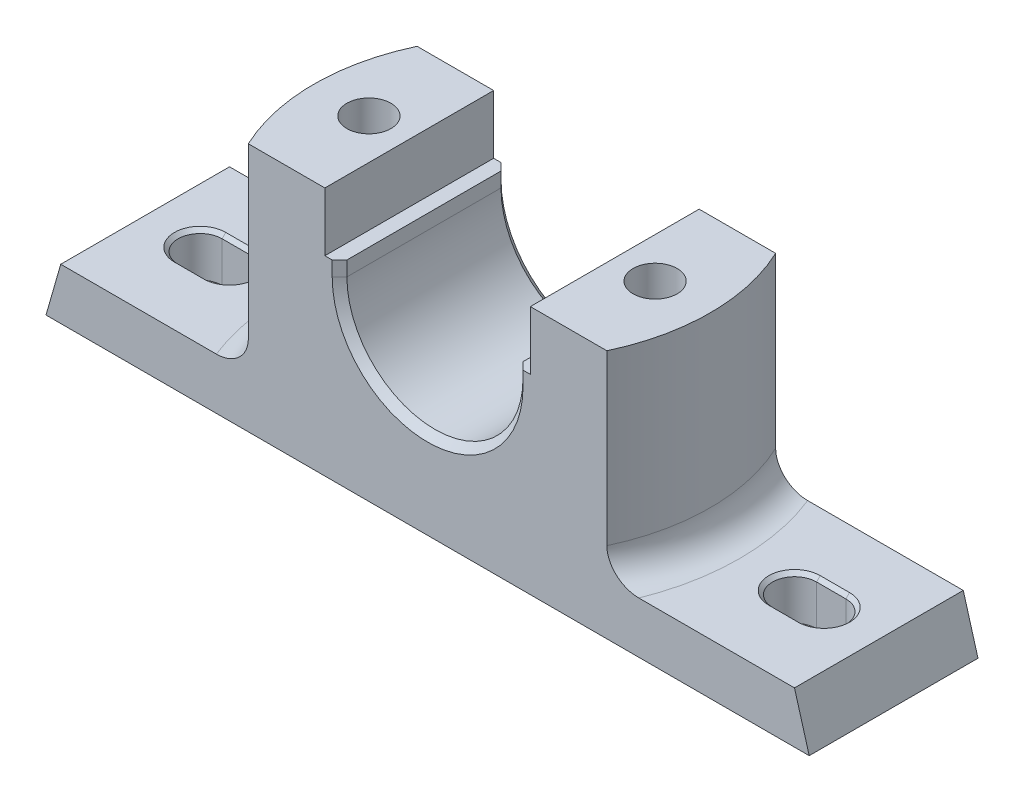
SolidWorks part; units mm, degrees
ref_plane "Front Plane" through (0, 0, 0) normal (0, 0, 1) x (1, 0, 0)
ref_plane "Top Plane" through (0, 0, 0) normal (0, 1, 0) x (1, 0, 0)
ref_plane "Right Plane" through (0, 0, 0) normal (1, 0, 0) x (0, 0, -1)
sketch "Sketch1" plane through (0, 0, 0) normal (0, 0, 1) x (1, 0, 0)
  line L0 (0, 0) -> (0, 97.2809) construction
  line L1 (-104, 0) -> (104, 0)
  line L2 (-104, 0) -> (-99.9856, 14)
  line L3 (104, 0) -> (99.9856, 14)
  line L4 (-99.9856, 14) -> (-54, 14)
  line L5 (99.9856, 14) -> (54, 14)
  line L6 (-54, 14) -> (-54, 68)
  line L7 (54, 14) -> (54, 68)
  line L8 (-54, 68) -> (-28, 68)
  line L9 (54, 68) -> (28, 68)
  line L10 (-28, 68) -> (-28, 52)
  line L11 (28, 68) -> (28, 52)
  line L12 (-28, 52) -> (-24, 52)
  line L13 (28, 52) -> (24, 52)
  line L14 (-24, 52) -> (-24, 48)
  line L15 (24, 52) -> (24, 48)
  arc A1 (-24, 48) -> (24, 48) centre (0, 48) ccw
  dimension "D5" = 48
  dimension "D9" = 4
  dimension "D1" = 208
  dimension "D2" = 68
  dimension "D3" = 14
  dimension "D4" = 106
  dimension "D6" = 56
  dimension "D7" = 54
  dimension "D8" = 16
extrude "Boss-Extrude1" add sketch "Sketch1" along normal mid plane 46
sketch "Sketch2" plane through (0, 68, 0) normal (0, 1, 0) x (1, 0, 0)
  line L0 (-48.8569, 23) -> (48.8569, 23)
  line L1 (48.8569, -23) -> (-48.8569, -23)
  line L3 (-28, -23) -> (-54, -23) construction
  line L8 (-54, -23) -> (-54, 23) construction
  line L9 (-28, 23) -> (-54, 23) construction
  line L10 (54, -23) -> (54, 23) construction
  line L12 (-48.8569, 23) -> (48.8569, -23) construction
  line L13 (48.8569, 23) -> (-48.8569, -23) construction
  arc A0 (-48.8569, 23) -> (-48.8569, -23) centre (0, 0) ccw
  arc A1 (48.8569, 23) -> (48.8569, -23) centre (0, 0) cw
  dimension "D1" = 54
extrude "Cut-Extrude1" cut sketch "Sketch2" against normal up to surface (54 mm away) flip side to cut
sketch "Sketch4" plane through (0, 0, 0) normal (0, -1, 0) x (1, 0, 0)
  line L0 (-104, 0) -> (104, 0) construction
  line L1 (-97.5, 17.5) -> (97.5, 17.5)
  line L2 (-97.5, 17.5) -> (-97.5, -17.5)
  line L3 (-97.5, -17.5) -> (97.5, -17.5)
  line L4 (97.5, 17.5) -> (97.5, -17.5)
  line L5 (-104, 23) -> (-104, -23) construction
  line L6 (104, 23) -> (104, -23) construction
  line L7 (0, 23) -> (0, -23) construction
  line L8 (-104, 23) -> (104, 23) construction
  line L9 (-104, -23) -> (104, -23) construction
  dimension "D1" = 195
  dimension "D2" = 35
extrude "Cut-Extrude2" cut sketch "Sketch4" against normal blind 2
sketch "Sketch5" plane through (0, 2, 0) normal (0, -1, 0) x (1, 0, 0)
  line L0 (-39, 0) -> (39, 0) construction
  line L1 (-53, -14) -> (-25, -14)
  line L2 (-53, -14) -> (-53, 14)
  line L3 (-53, 14) -> (-25, 14)
  line L4 (-25, -14) -> (-25, 14)
  line L5 (-53, -14) -> (-25, 14) construction
  line L6 (-53, 14) -> (-25, -14) construction
  line L7 (25, -14) -> (53, -14)
  line L8 (25, -14) -> (25, 14)
  line L9 (25, 14) -> (53, 14)
  line L10 (53, -14) -> (53, 14)
  line L11 (25, -14) -> (53, 14) construction
  line L12 (25, 14) -> (53, -14) construction
  point P0 (-39, 0)
  point P5 (39, 0)
  point P12 (0, 0)
  dimension "D1" = 28
  dimension "D2" = 78
extrude "Cut-Extrude3" cut sketch "Sketch5" against normal blind 10
other "Hole1"
sketch "Sketch6" plane through (0, 68, 0) normal (0, 1, 0) x (1, 0, 0)
  line L0 (-39, 0) -> (0, 0) construction
  circle A0 centre (-39, 0) radius 6
  dimension "D1" = 12
  dimension "D2" = 39
other "Hole2"
sketch "Sketch7" plane through (0, 68, 0) normal (0, 1, 0) x (1, 0, 0)
  line L0 (0, 0) -> (39, 0) construction
  circle A0 centre (39, 0) radius 6
  circle A1 centre (-39, 0) radius 6 construction
  dimension "D1" = 12
  dimension "D2" = 78
sketch "Sketch8" plane through (0, 14, 0) normal (0, 1, 0) x (1, 0, 0)
  line L0 (77, 0) -> (85, 0) construction
  line L1 (77, 6) -> (85, 6)
  line L2 (77, -6) -> (85, -6)
  line L3 (-85, 0) -> (-77, 0) construction
  line L4 (-85, 6) -> (-77, 6)
  line L5 (-85, -6) -> (-77, -6)
  line L6 (-77, 0) -> (77, 0) construction
  arc A0 (77, 6) -> (77, -6) centre (77, 0) ccw
  arc A1 (85, -6) -> (85, 6) centre (85, 0) ccw
  arc A2 (-85, 6) -> (-85, -6) centre (-85, 0) ccw
  arc A3 (-77, -6) -> (-77, 6) centre (-77, 0) ccw
  point P2 (81, 0)
  point P9 (-81, 0)
  point P17 (0, 0)
  dimension "D5" = 154
  dimension "D1" = 12
  dimension "D2" = 8
  dimension "D3" = 12
  dimension "D4" = 8
extrude "Cut-Extrude4" cut sketch "Sketch8" against normal through all
fillet "Fillet1" radius 8 2 edges at (-54, 14, 0) (54, 14, 0)
chamfer "Chamfer1" distance 1 angle 45 8 edges at (91, 14, 0) (81, 14, -6) (71, 14, 0) (81, 14, 6) (-81, 14, -6) (-91, 14, 0) (-71, 14, 0) (-81, 14, 6)
chamfer "Chamfer2" distance 2 angle 45 6 edges at (24, 50, -23) (-24, 50, -23) (0, 24, -23) (24, 50, 23) (-24, 50, 23) (0, 24, 23)
